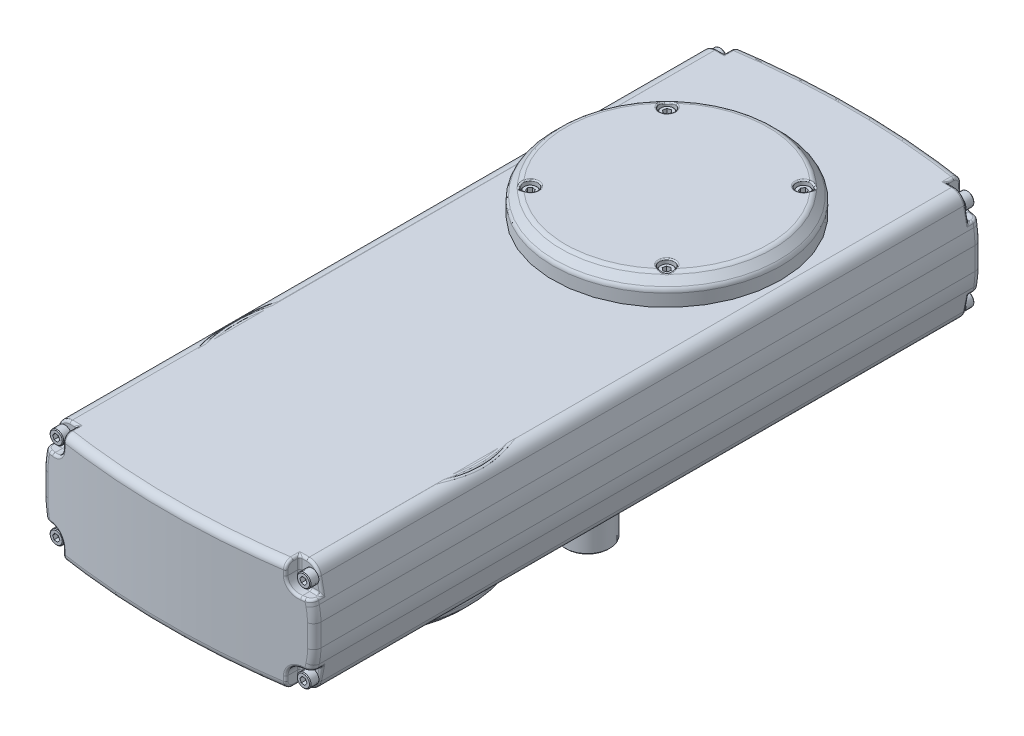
SolidWorks part; units mm, degrees
other "NONE"
ref_plane "前视基准面" through (0, 0, 0) normal (0, 0, 1) x (1, 0, 0)
ref_plane "上视基准面" through (0, 0, 0) normal (0, 1, 0) x (1, 0, 0)
ref_plane "右视基准面" through (0, 0, 0) normal (1, 0, 0) x (0, 0, -1)
imported_body "输入1"
sketch "草图1" plane through (-55.3034, 0, -0.0746) normal (-1, 0, -0.0013) x (-0.0013, 0, 1)
  line L0 (-173.8893, 9) -> (-148.5792, 9)
  line L1 (-289.9998, 9) -> (-32.9998, 9) construction
surface "曲面-拉伸1" sketch "草图1" parameters "D1"=81
split "分割1" trimming surface bodies 110 bodies to split 109 resulting bodies 111 112
sketch "草图2" plane through (0, 0, 0) normal (1, 0, 0) x (0, 0, -1)
  line L0 (224.9583, 63.2678) -> (224.9583, -19.1102) construction
  line L1 (254.488, 63.2678) -> (195.4287, 63.2678) construction
move or copy body "实体-移动/复制1" bodies to move or copy 112 copy no rotation origin (0, 0, -224.9583) rotation axis (0, -1, 0) rotation angle 25
move or copy body "实体-移动/复制2" bodies to move or copy 113 copy yes number of copies 1 rotation origin (0, 0, -224.9583) rotation axis (0, 1, 0) rotation angle 50
combine bodies "组合1" operation type add bodies to combine 111 113 114
delete or keep bodies "实体-删除/保留 1" type delete bodies bodies 110
